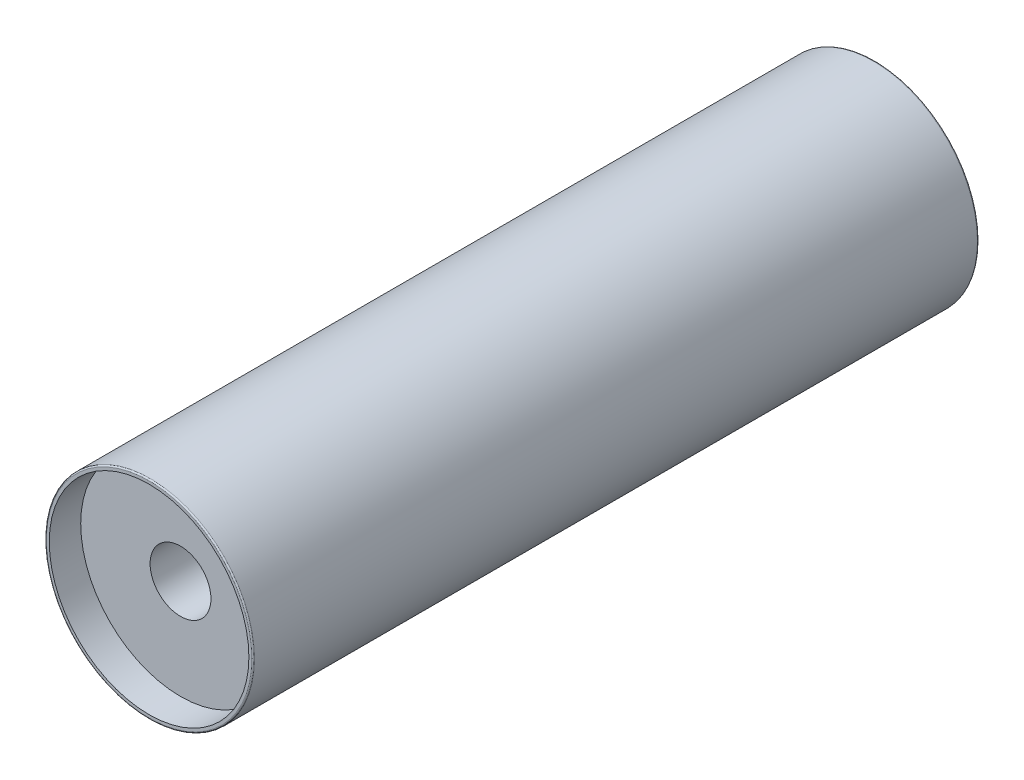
SolidWorks part; units mm, degrees
ref_plane "Plane1" through (0, 0, 0) normal (0, 0, 1) x (1, 0, 0)
ref_plane "Plane2" through (0, 0, 0) normal (0, 1, 0) x (1, 0, 0)
ref_plane "Plane3" through (0, 0, 0) normal (1, 0, 0) x (0, 0, -1)
sketch "Sketch1" plane through (0, 0, 0) normal (0, 0, 1) x (1, 0, 0)
  circle A0 centre (0, 0) radius 19.85
  dimension "D1" = 39.7
extrude "Base-Extrude" add sketch "Sketch1" along normal mid plane 138.5
sketch "Sketch2" plane through (0, 0, 0) normal (0, 0, 1) x (1, 0, 0)
  circle A0 centre (0, 0) radius 19.05
  dimension "D1" = 38.1
extrude "StrokeChamber" cut sketch "Sketch2" along normal mid plane 81.2
sketch "Sketch3" plane through (0, 0, 0) normal (0, 0, 1) x (1, 0, 0)
  circle A0 centre (0, 0) radius 5.8063
  dimension "D1" = 11.6125
extrude "RodBore" cut sketch "Sketch3" against normal through all and the other way through all
fillet "Fillet1" radius 0.25 2 edges at (19.85, 0, -69.25) (19.85, 0, 69.25)
sketch "Sketch4" plane through (0, 0, 69.25) normal (0, 0, 1) x (1, 0, 0)
  circle A0 centre (0, 0) radius 19.05
  dimension "D1" = 38.1
extrude "Cut-Extrude1" cut sketch "Sketch4" against normal blind 6
mirror "Mirror1" about plane through (0, 0, 0) normal (0, 0, 1) of "Cut-Extrude1"
ref_plane "Plane4" through (0, 27.5, 0) normal (0, 1, 0) x (-1, 0, 0)
sketch "Sketch5" plane through (0, 27.5, 0) normal (0, 1, 0) x (-1, 0, 0)
  line L0 (-6.9411, 48.5228) -> (-6.9411, -47.9214) construction
  text T0 "SolidWorks" font "Century Gothic" height 14
extrude "Cut-Extrude3" cut sketch "Sketch5" against normal offset from surface (8.9799 mm away) 1
